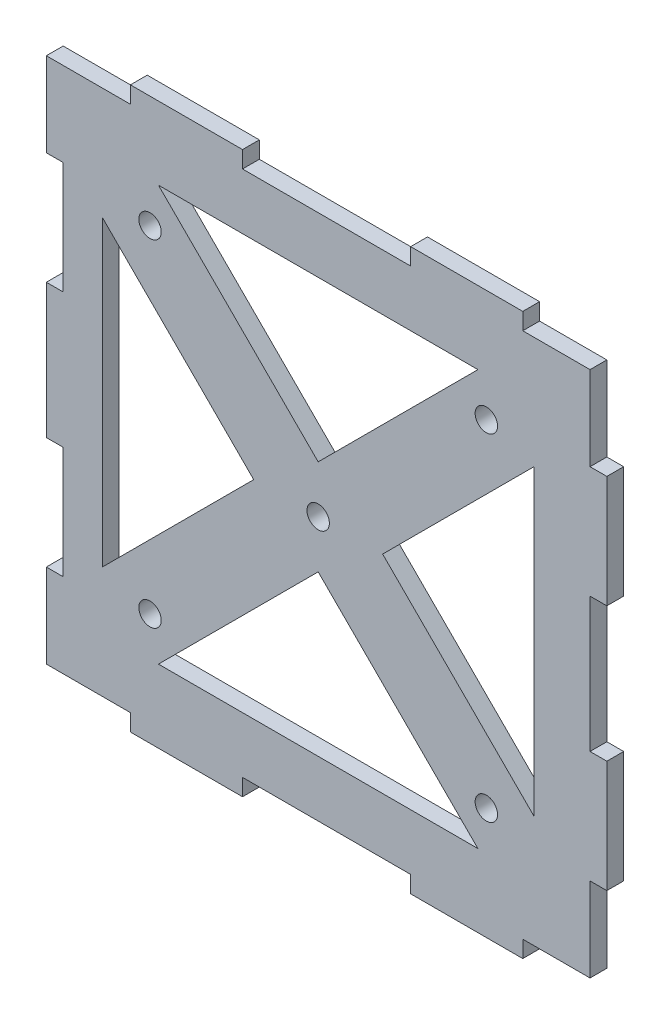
SolidWorks part; units mm, degrees
ref_plane "Plan de face" through (0, 0, 0) normal (0, 0, 1) x (1, 0, 0)
ref_plane "Plan de dessus" through (0, 0, 0) normal (0, 1, 0) x (1, 0, 0)
ref_plane "Plan de droite" through (0, 0, 0) normal (1, 0, 0) x (0, 0, -1)
sketch "Esquisse1" plane through (0, 0, 0) normal (0, 0, 1) x (1, 0, 0)
  line L0 (-36.3514, 95.5523) -> (-36.3514, -4.4477) construction
  line L1 (-84.8514, 97.4275) -> (12.1486, 97.4275)
  line L2 (-84.8514, 97.4275) -> (-84.8514, 3.4275)
  line L3 (-84.8514, 3.4275) -> (12.1486, 3.4275)
  line L4 (12.1486, 97.4275) -> (12.1486, 3.4275)
  line L5 (-74.8514, 87.4275) -> (2.1486, 87.4275)
  line L6 (-74.8514, 87.4275) -> (-74.8514, 13.4275)
  line L7 (-74.8514, 13.4275) -> (2.1486, 13.4275)
  line L8 (2.1486, 87.4275) -> (2.1486, 13.4275)
  line L9 (-94.8547, 50.4275) -> (5.1453, 50.4275) construction
  line L10 (-74.8514, 77.4275) -> (-47.8514, 50.4275)
  line L11 (-64.8514, 87.4275) -> (-36.3514, 58.9275)
  line L12 (-74.8514, 23.4275) -> (-47.8514, 50.4275)
  line L13 (-7.8514, 87.4275) -> (-36.3514, 58.9275)
  line L14 (2.1486, 77.4275) -> (-24.8514, 50.4275)
  line L15 (-64.8514, 13.4275) -> (-36.3514, 41.9275)
  line L16 (-36.3514, 41.9275) -> (-7.8514, 13.4275)
  line L17 (-24.8514, 50.4275) -> (2.1486, 23.4275)
  line L19 (-66.3514, 80.4275) -> (-6.3514, 80.4275) construction
  line L20 (-66.3514, 80.4275) -> (-66.3514, 20.4275) construction
  line L21 (-66.3514, 20.4275) -> (-6.3514, 20.4275) construction
  line L22 (-6.3514, 80.4275) -> (-6.3514, 20.4275) construction
  circle A0 centre (-36.3514, 50.4275) radius 2
  circle A1 centre (-66.3514, 80.4275) radius 2
  circle A2 centre (-6.3514, 80.4275) radius 2
  circle A3 centre (-6.3514, 20.4275) radius 2
  circle A4 centre (-66.3514, 20.4275) radius 2
  point P15 (12.1486, 50.4275)
  point P23 (-36.3514, 3.4275)
  point P36 (-66.3514, 50.4275)
  point P37 (-36.3514, 20.4275)
  dimension "D25" = 4
  dimension "D26" = 4
  dimension "D27" = 4
  dimension "D28" = 4
  dimension "D29" = 4
  dimension "D1" = 97
  dimension "D2" = 94
  dimension "D3" = 10
  dimension "D4" = 10
  dimension "D5" = 10
  dimension "D6" = 10
  dimension "D7" = 45
  dimension "D8" = 45
  dimension "D9" = 10
  dimension "D10" = 10
  dimension "D11" = 45
  dimension "D12" = 10
  dimension "D13" = 45
  dimension "D14" = 10
  dimension "D15" = 45
  dimension "D16" = 10
  dimension "D17" = 10
  dimension "D18" = 10
  dimension "D19" = 10
  dimension "D20" = 45
  dimension "D21" = 45
  dimension "D22" = 45
  dimension "D23" = 0
  dimension "D24" = 0
  dimension "D30" = 0
  dimension "D31" = 0
  dimension "D32" = 60
extrude "Boss.-Extru.1" add sketch "Esquisse1" along normal blind 3 contours L4 L1 L2 L3 L5 L8 L7 L6 | L17 L14 L8 L5 L13 L11 L6 L10 L12 L7 L15 L16 A4 A3 A2 A1 A0
sketch "Esquisse2" plane through (0, 0, 3) normal (0, 0, 1) x (1, 0, 0)
  line L0 (-84.8514, 50.4275) -> (15.1486, 50.4275) construction
  line L1 (-84.8514, 97.4275) -> (-84.8514, 3.4275) construction
  line L6 (-81.8514, 18.4275) -> (-81.8514, 38.4275)
  line L11 (-84.8514, 82.4275) -> (-81.8514, 82.4275)
  line L12 (-84.8514, 82.4275) -> (-84.8514, 62.4275)
  line L13 (-84.8514, 62.4275) -> (-81.8514, 62.4275)
  line L14 (-81.8514, 82.4275) -> (-81.8514, 62.4275)
  line L15 (-84.8514, 38.4275) -> (-81.8514, 38.4275)
  line L16 (-84.8514, 18.4275) -> (-84.8514, 38.4275)
  line L17 (-84.8514, 18.4275) -> (-81.8514, 18.4275)
  point P12 (-84.8514, 50.4275)
  dimension "D1" = 0
  dimension "D3" = 15
  dimension "D6" = 20
  dimension "D8" = 3
extrude "Enlèv. mat.-Extru.1" cut sketch "Esquisse2" against normal up to next
sketch "Esquisse3" plane through (0, 97.4275, 0) normal (0, 1, 0) x (1, 0, 0)
  line L0 (-84.8514, 0) -> (12.1486, 0) construction
  line L1 (-69.8514, 0) -> (-49.8514, 0)
  line L2 (-69.8514, 0) -> (-69.8514, -3)
  line L3 (-69.8514, -3) -> (-49.8514, -3)
  line L4 (-49.8514, 0) -> (-49.8514, -3)
  line L5 (-84.8514, -3) -> (12.1486, -3) construction
  line L6 (-84.8514, -3) -> (-84.8514, 0) construction
  line L8 (-19.8514, 0) -> (-19.8514, -3)
  line L9 (0.1486, -3) -> (-19.8514, -3)
  line L10 (0.1486, 0) -> (0.1486, -3)
  line L11 (0.1486, 0) -> (-19.8514, 0)
  point P10 (-19.8514, 0)
  dimension "D1" = 15
  dimension "D2" = 20
  dimension "D3" = 30
  dimension "D4" = 20
extrude "Boss.-Extru.2" add sketch "Esquisse3" along normal blind 3
sketch "Esquisse4" plane through (12.1486, 0, 0) normal (1, 0, 0) x (0, 0, -1)
  line L0 (-3, 97.4275) -> (-3, 3.4275) construction
  line L1 (-3, 82.4275) -> (0, 82.4275)
  line L2 (-3, 82.4275) -> (-3, 62.4275)
  line L3 (-3, 62.4275) -> (0, 62.4275)
  line L4 (0, 82.4275) -> (0, 62.4275)
  line L5 (0, 97.4275) -> (0, 3.4275) construction
  line L6 (-3, 97.4275) -> (0, 97.4275) construction
  line L7 (-3, 50.4275) -> (0, 50.4275) construction
  line L8 (0, 18.4275) -> (0, 38.4275)
  line L9 (-3, 38.4275) -> (0, 38.4275)
  line L10 (-3, 18.4275) -> (-3, 38.4275)
  line L11 (-3, 18.4275) -> (0, 18.4275)
  dimension "D1" = 15
  dimension "D2" = 20
extrude "Boss.-Extru.3" add sketch "Esquisse4" along normal blind 3
sketch "Esquisse5" plane through (0, 3.4275, 0) normal (0, -1, 0) x (1, 0, 0)
  line L0 (-84.8514, 3) -> (12.1486, 3) construction
  line L1 (-69.8514, 3) -> (-49.8514, 3)
  line L2 (-69.8514, 3) -> (-69.8514, 0)
  line L3 (-69.8514, 0) -> (-49.8514, 0)
  line L4 (-49.8514, 3) -> (-49.8514, 0)
  line L5 (-84.8514, 0) -> (12.1486, 0) construction
  line L6 (-84.8514, 3) -> (-84.8514, 0) construction
  line L7 (-19.8514, 3) -> (0.1486, 3)
  line L8 (-19.8514, 3) -> (-19.8514, 0)
  line L9 (-19.8514, 0) -> (0.1486, 0)
  line L10 (0.1486, 3) -> (0.1486, 0)
  dimension "D1" = 15
  dimension "D2" = 20
  dimension "D3" = 30
  dimension "D4" = 20
extrude "Boss.-Extru.4" add sketch "Esquisse5" along normal blind 3
